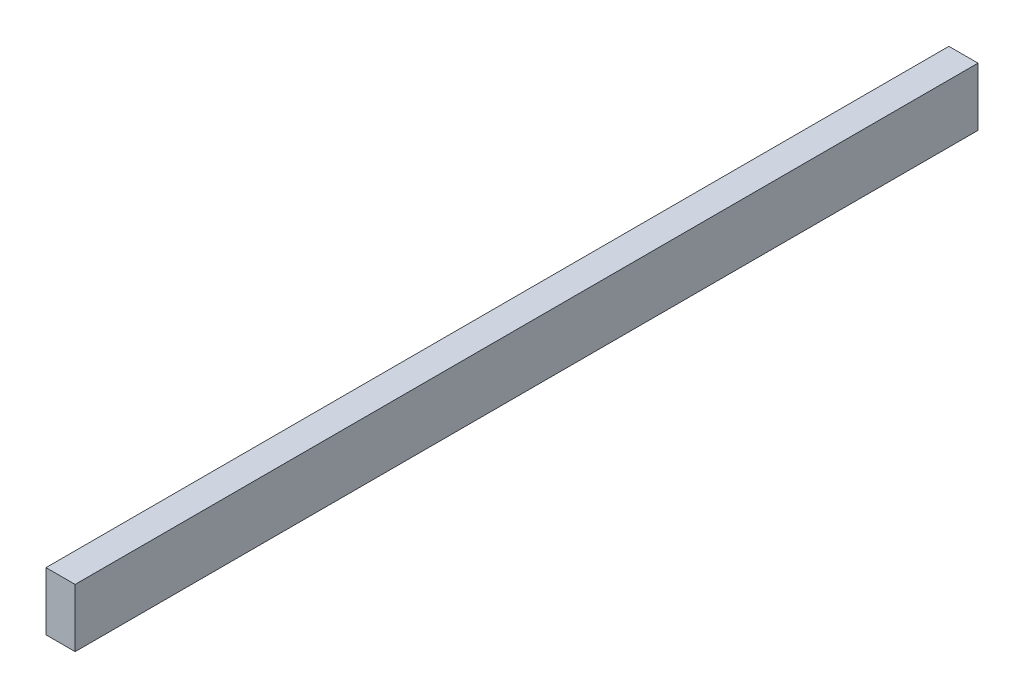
SolidWorks part; units mm, degrees
ref_plane "Plan de face" through (0, 0, 0) normal (0, 0, 1) x (1, 0, 0)
ref_plane "Plan de dessus" through (0, 0, 0) normal (0, 1, 0) x (1, 0, 0)
ref_plane "Plan de droite" through (0, 0, 0) normal (1, 0, 0) x (0, 0, -1)
sketch "Esquisse1" plane through (0, 0, 0) normal (0, 0, 1) x (1, 0, 0)
  line L1 (0, 0) -> (15, 0)
  line L2 (0, 0) -> (0, 30)
  line L3 (0, 30) -> (15, 30)
  line L4 (15, 0) -> (15, 30)
  dimension "D1" = 30
  dimension "D2" = 15
extrude "Extrusion1" add sketch "Esquisse1" along normal blind 465
hole_wizard "Trou taraudé M10x1.51" positions "Esquisse3D1" profile "Esquisse2" tap size "M10x1.5" standard "Ansi Métrique"
sketch3d "Esquisse3D1"
  line L0 (0, 30, 465) -> (0, 30, 0) construction
  line L1 (0, 30, 465) -> (0, 0, 465) construction
  point P0 (0, 9, 107.5)
  point P2 (0, 9, 232.5)
  point P4 (0, 9, 357.5)
  dimension "D1" = 21
  dimension "D2" = 21
  dimension "D3" = 21
  dimension "D4" = 107.5
  dimension "D5" = 125
  dimension "D6" = 125
sketch "Esquisse2" plane through (0, 9, 107.5) normal (0, 1, 0) x (0, 0, 1)
  line L0 (0, 0) -> (0, 22.4034)
  line L1 (0, 22.4034) -> (4, 20)
  line L2 (4, 20) -> (4, 0)
  line L5 (4, 0) -> (0, 0)
  line L10 (0, 22.4034) -> (-4, 20) construction
  line L11 (0, -6.35) -> (0, 107.95) construction
  dimension "Diamètre du trou pour taraudage" = 8
  dimension "Profondeur du trou pour taraudage" = 20
  dimension "Angle de pointe" = 118
